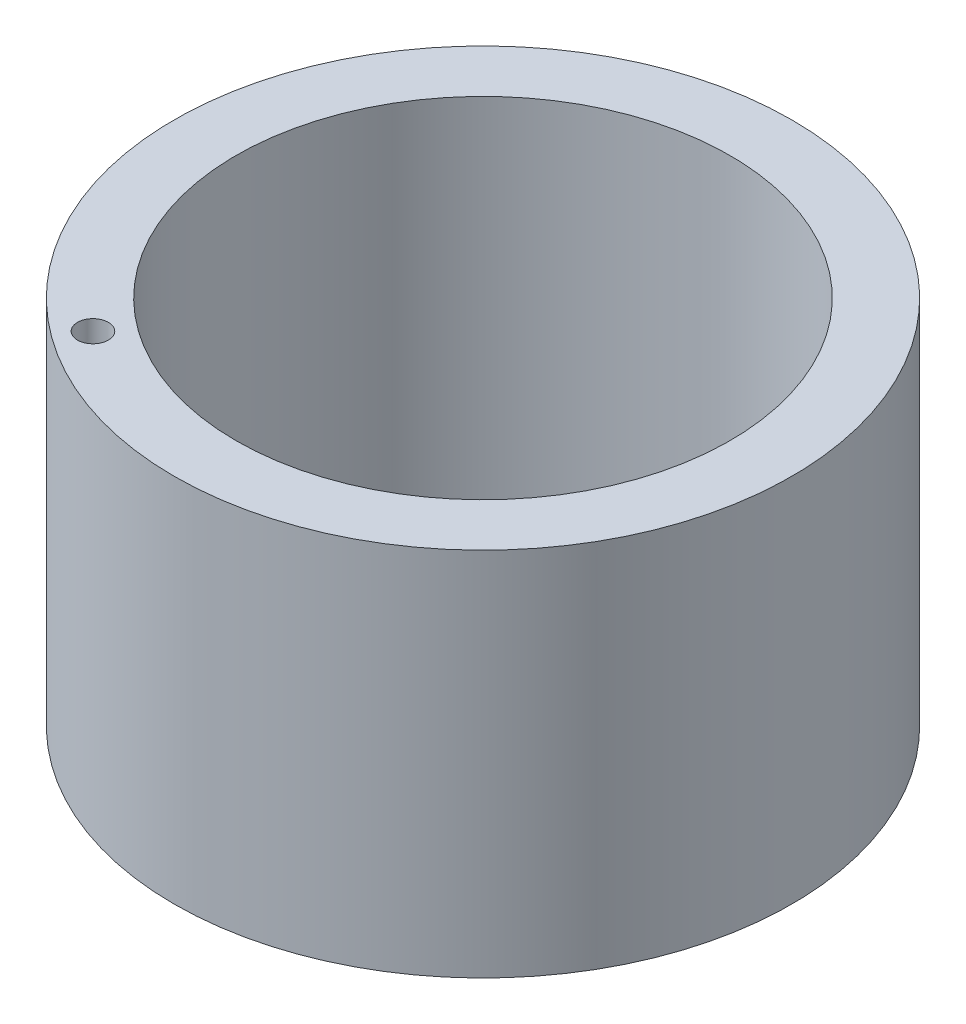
SolidWorks part; units mm, degrees
ref_plane "Front Plane" through (0, 0, 0) normal (0, 0, 1) x (1, 0, 0)
ref_plane "Top Plane" through (0, 0, 0) normal (0, 1, 0) x (1, 0, 0)
ref_plane "Right Plane" through (0, 0, 0) normal (1, 0, 0) x (0, 0, -1)
sketch "Sketch1" plane through (0, 0, 0) normal (0, 1, 0) x (1, 0, 0)
  circle A0 centre (0, 0) radius 25
  circle A1 centre (0, 0) radius 20
  dimension "D1" = 40
  dimension "D2" = 50
extrude "Boss-Extrude1" add sketch "Sketch1" along normal blind 30
hole_wizard "Ø2.5mm Dowel Hole1" positions "Sketch3" profile "Sketch2" hole size "Ø2.5" standard "ISO"
sketch "Sketch3" plane through (0, 30, 0) normal (0, 1, 0) x (1, 0, 0)
  point P0 (-13.4663, -18.1149)
sketch "Sketch2" plane through (-13.4663, 30, 18.1149) normal (1, 0, 0) x (0, 0, 1)
  line L0 (0, 0) -> (0, 25.7511)
  line L1 (0, 25.7511) -> (1.25, 25)
  line L2 (1.25, 25) -> (1.25, 0)
  line L5 (1.25, 0) -> (0, 0)
  line L10 (0, 25.7511) -> (-1.25, 25) construction
  line L11 (0, -6.35) -> (0, 107.95) construction
  dimension "Hole Dia." = 2.5
  dimension "Hole Depth" = 25
  dimension "Drill Angle" = 118
